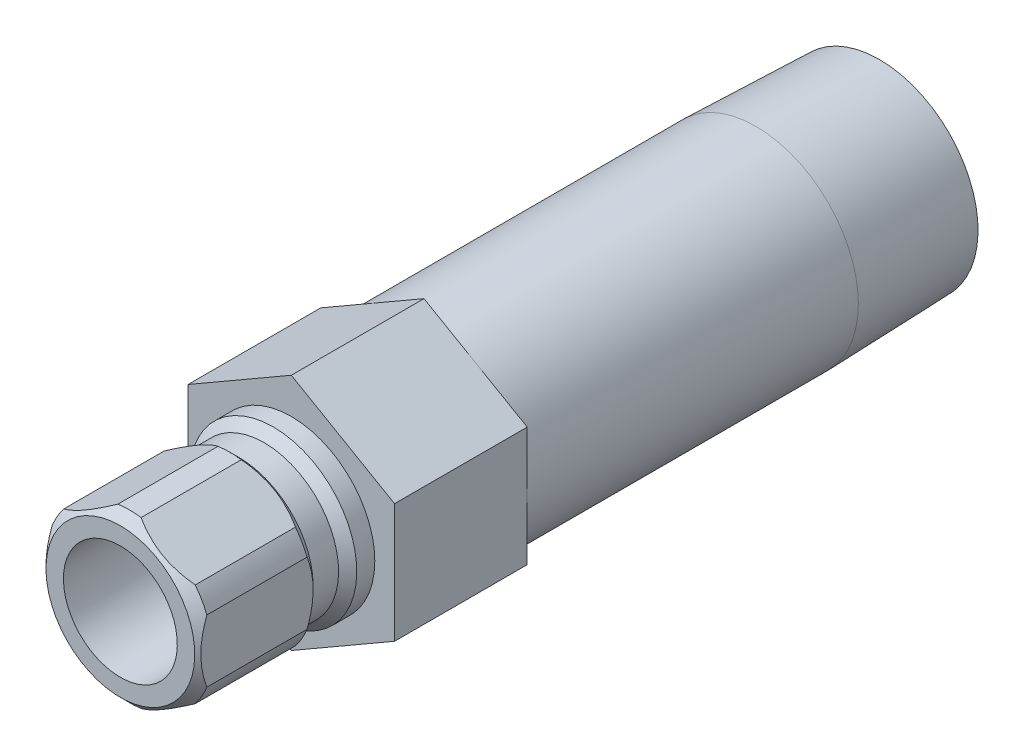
SolidWorks part; units mm, degrees
ref_plane "Front Plane" through (0, 0, 0) normal (0, 0, 1) x (1, 0, 0)
ref_plane "Top Plane" through (0, 0, 0) normal (0, 1, 0) x (1, 0, 0)
ref_plane "Right Plane" through (0, 0, 0) normal (1, 0, 0) x (0, 0, -1)
sketch "Sketch1" plane through (0, 0, 0) normal (1, 0, 0) x (0, 0, -1)
  line L0 (0, 0) -> (-17.4752, 0) construction
  line L1 (-14.3002, 4.7625) -> (-14.3002, 6.223)
  line L2 (-4.3942, 6.223) -> (-4.3942, 0) construction
  line L3 (-13.5382, 6.985) -> (-5.1562, 6.985)
  line L4 (3.175, 8.5725) -> (0, 0) construction
  line L5 (-4.3942, 6.223) -> (-2.2708, 6.223)
  line L6 (-1.5088, 6.985) -> (3.175, 6.985)
  line L7 (3.175, 6.985) -> (3.175, 8.5725)
  line L8 (-4.3942, 6.223) -> (-5.1562, 6.985)
  line L9 (-2.2708, 6.223) -> (-1.5088, 6.985)
  line L10 (-14.3002, 6.223) -> (-13.5382, 6.985)
  line L11 (-14.3002, 4.7625) -> (11.0998, 4.7625)
  line L12 (3.175, 8.5725) -> (38.862, 8.5725)
  line L13 (38.862, 8.5725) -> (49.1998, 8.2494)
  line L14 (49.1998, 8.2494) -> (49.1998, 6.2611)
  line L15 (0, 8.5725) -> (0, 0) construction
  line L16 (11.0998, 4.7625) -> (11.0998, 0) construction
  line L17 (11.0998, 0) -> (0, 0) construction
  line L18 (11.0998, 4.7625) -> (11.0998, 6.2611)
  line L19 (11.0998, 6.2611) -> (49.1998, 6.2611)
  dimension "D1" = 17.4752
  dimension "D2" = 2.1234
  dimension "D3" = 0.762
  dimension "D4" = 45
  dimension "D5" = 9.906
  dimension "D6" = 45
  dimension "D7" = 1.79
  dimension "D8" = 10.3378
  dimension "D9" = 63.5
  dimension "D10" = 3.175
  dimension "D11" = 9.525
  dimension "D12" = 17.145
  dimension "D13" = 25.4
  dimension "D14" = 13.97
  dimension "D15" = 12.5222
  dimension "D16" = 11.0998
revolve "Revolve1" add sketch "Sketch1" angle 360 about L0
sketch "Sketch2" plane through (0, 0, 0) normal (0, 0, 1) x (1, 0, 0)
  line L1 (-8.636, 4.986) -> (-8.636, -4.986)
  line L2 (-8.636, -4.986) -> (0, -9.972)
  line L3 (0, -9.972) -> (8.636, -4.986)
  line L4 (8.636, -4.986) -> (8.636, 4.986)
  line L5 (8.636, 4.986) -> (0, 9.972)
  line L6 (0, 9.972) -> (-8.636, 4.986)
  circle A0 centre (0, 0) radius 8.636 construction
  circle A1 centre (0, 0) radius 4.7625 construction
  circle A2 centre (0, 0) radius 4.7625
  dimension "D1" = 17.272
extrude "Boss-Extrude1" add sketch "Sketch2" against normal up to vertex (11.0998 mm away)
sketch "Sketch3" plane through (0, 0, 0) normal (0, 0, 1) x (1, 0, 0)
  line L1 (6.477, -3.7395) -> (6.477, 3.7395)
  line L2 (6.477, 3.7395) -> (0, 7.479)
  line L3 (0, 7.479) -> (-6.477, 3.7395)
  line L4 (-6.477, 3.7395) -> (-6.477, -3.7395)
  line L5 (-6.477, -3.7395) -> (0, -7.479)
  line L6 (0, -7.479) -> (6.477, -3.7395)
  circle A0 centre (0, 0) radius 6.477 construction
  dimension "D1" = 12.954
extrude "Cut-Extrude1" cut sketch "Sketch3" along normal through all from vertex at 4.3942 flip side to cut
